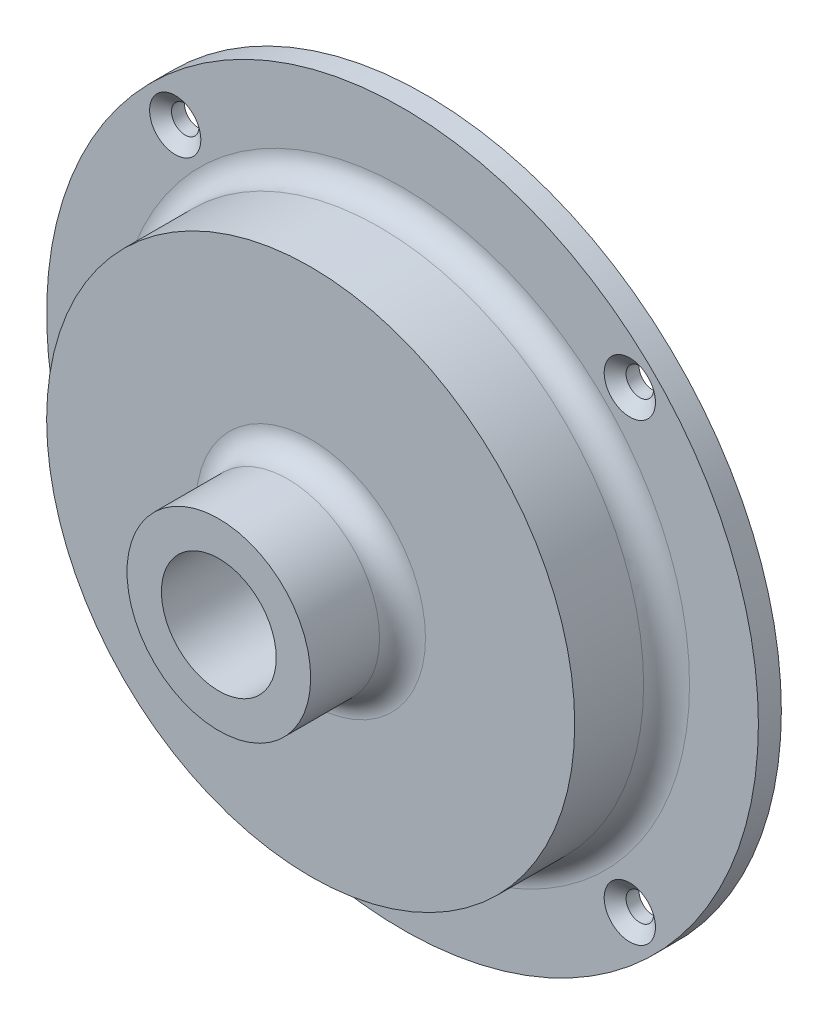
SolidWorks part; units mm, degrees
ref_plane "Front" through (0, 0, 0) normal (0, 0, 1) x (1, 0, 0)
ref_plane "Top" through (0, 0, 0) normal (0, 1, 0) x (1, 0, 0)
ref_plane "Right" through (0, 0, 0) normal (1, 0, 0) x (0, 0, -1)
sketch "Sketch1" plane through (0, 0, 0) normal (0, 0, 1) x (1, 0, 0)
  circle A0 centre (0, 0) radius 49.2125
  dimension "D1" = 98.425
extrude "Base-Extrude" add sketch "Sketch1" along normal blind 3.175
sketch "Sketch2" plane through (0, 0, 3.175) normal (0, 0, 1) x (1, 0, 0)
  circle A0 centre (0, 0) radius 36.5125
  dimension "D1" = 73.025
extrude "Boss-Extrude1" add sketch "Sketch2" along normal blind 12.7
sketch "Sketch3" plane through (0, 0, 15.875) normal (0, 0, 1) x (1, 0, 0)
  circle A0 centre (0, 0) radius 12.7
  dimension "D1" = 25.4
extrude "Boss-Extrude2" add sketch "Sketch3" along normal blind 12.7
fillet "Fillet1" radius 3.175 2 edges at (36.5125, 0, 3.175) (12.7, 0, 15.875)
sketch "Sketch4" plane through (0, 0, 28.575) normal (0, 0, 1) x (1, 0, 0)
  circle A0 centre (0, 0) radius 7.9375
  dimension "D1" = 15.875
extrude "Cut-Extrude1" cut sketch "Sketch4" against normal through all
sketch "Sketch8" plane through (0, 0, 3.175) normal (0, 0, 1) x (1, 0, 0)
  line L0 (0, 0) -> (31.4309, -31.4309) construction
  line L1 (0, 0) -> (44.45, 0) construction
  circle A0 centre (0, 0) radius 44.45 construction
  dimension "D2" = 88.9
  dimension "D1" = 45
hole_wizard "CSK for #6 Flat Head Machine Screw (100)1" positions "Sketch10" profile "Sketch9" countersink size "#6" standard "Ansi Inch"
sketch "Sketch10" plane through (0, 0, 3.175) normal (0, 0, 1) x (1, 0, 0)
  point P0 (31.4309, -31.4309)
sketch "Sketch9" plane through (31.4309, -31.4309, 3.175) normal (1, 0, 0) x (0, -1, 0)
  line L0 (0, 0) -> (0, 3.175)
  line L1 (0, 3.175) -> (1.8986, 3.175)
  line L2 (1.8986, 3.175) -> (1.8986, 1.38)
  line L3 (1.8986, 1.38) -> (3.5433, 0)
  line L5 (3.5433, 0) -> (0, 0)
  line L6 (-1.8987, 1.38) -> (-3.5433, 0) construction
  line L11 (0, -6.35) -> (0, 107.95) construction
  dimension "Thru Hole Dia." = 3.7973
  dimension "Thru Hole Depth" = 3.175
  dimension "Near C'Sink Dia." = 7.0866
  dimension "Near C'Sink Angle" = 100
pattern_circular "CirPattern2" count 4 over 360 about axis through (0, 0, 0) along (0, 0, 1) of "CSK for #6 Flat Head Machine Screw (100)1"
